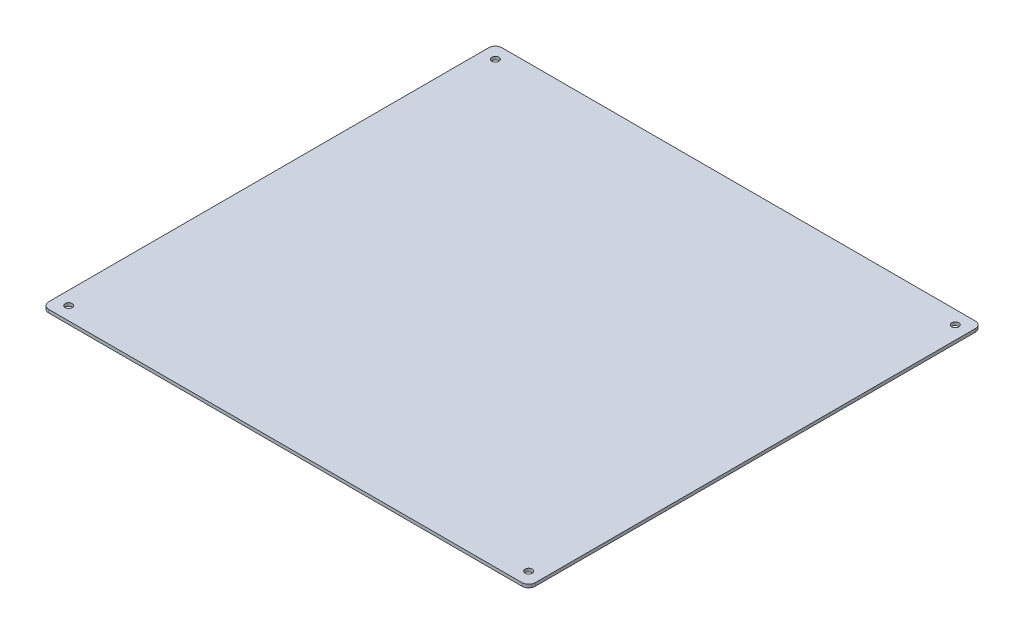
SolidWorks part; units mm, degrees
ref_plane "Front Plane" through (0, 0, 0) normal (0, 0, 1) x (1, 0, 0)
ref_plane "Top Plane" through (0, 0, 0) normal (0, 1, 0) x (1, 0, 0)
ref_plane "Right Plane" through (0, 0, 0) normal (1, 0, 0) x (0, 0, -1)
sketch "Sketch3" plane through (0, 0, 0) normal (0, 1, 0) x (1, 0, 0)
  line L1 (-231.775, -215.9) -> (231.775, -215.9)
  line L2 (-231.775, -215.9) -> (-231.775, 215.9)
  line L3 (-231.775, 215.9) -> (231.775, 215.9)
  line L4 (231.775, -215.9) -> (231.775, 215.9)
  line L5 (-231.775, -215.9) -> (231.775, 215.9) construction
  line L6 (-231.775, 215.9) -> (231.775, -215.9) construction
  point P0 (0, 0)
  dimension "D1" = 463.55
  dimension "D2" = 431.8
extrude "Boss-Extrude1" add sketch "Sketch3" along normal blind 2.9972
hole_wizard "17/64 (0.26563) Diameter Hole1" positions "Sketch4" profile "Sketch5" hole size "17/64" standard "ANSI Inch"
sketch "Sketch4" plane through (0, 2.9972, 0) normal (0, 1, 0) x (1, 0, 0)
  line L1 (-219.075, -203.2) -> (219.075, -203.2) construction
  line L2 (-219.075, -203.2) -> (-219.075, 203.2) construction
  line L3 (-219.075, 203.2) -> (219.075, 203.2) construction
  line L4 (219.075, -203.2) -> (219.075, 203.2) construction
  line L5 (-219.075, -203.2) -> (219.075, 203.2) construction
  line L6 (-219.075, 203.2) -> (219.075, -203.2) construction
  line L7 (231.775, -215.9) -> (231.775, 215.9) construction
  line L8 (-231.775, -215.9) -> (231.775, -215.9) construction
  point P0 (-219.075, 203.2)
  point P2 (-219.075, -203.2)
  point P4 (219.075, -203.2)
  point P6 (219.075, 203.2)
  dimension "D1" = 406.4
  dimension "D2" = 438.15
  dimension "D3" = 12.7
  dimension "D4" = 12.7
sketch "Sketch5" plane through (-219.075, 2.9972, -203.2) normal (1, 0, 0) x (0, 0, 1)
  line L0 (0, 0) -> (0, 2.9972)
  line L1 (0, 2.9972) -> (3.3735, 2.9972)
  line L2 (3.3735, 2.9972) -> (3.3735, 0)
  line L5 (3.3735, 0) -> (0, 0)
  line L11 (0, -6.35) -> (0, 107.95) construction
  dimension "Thru Hole Dia." = 6.747
  dimension "Thru Hole Depth" = 2.9972
fillet "Fillet1" radius 6.35 4 edges at (231.775, 1.4986, -215.9) (231.775, 1.4986, 215.9) (-231.775, 1.4986, 215.9) (-231.775, 1.4986, -215.9)
